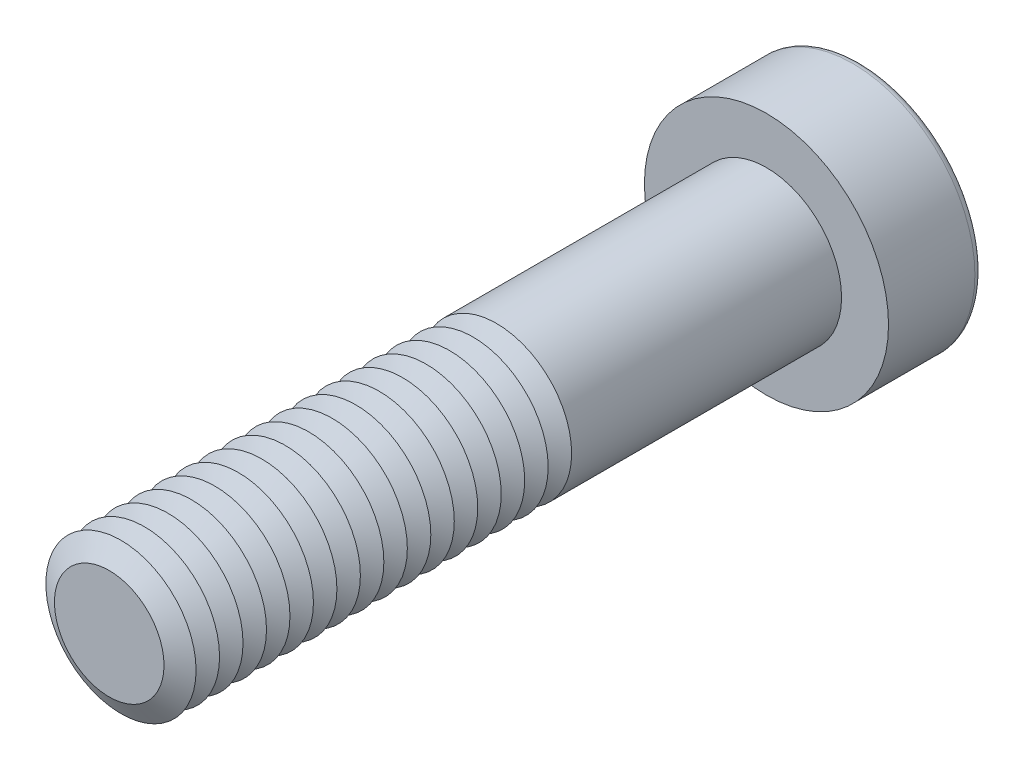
SolidWorks part; units mm, degrees
ref_plane "Front Plane" through (0, 0, 0) normal (0, 0, 1) x (1, 0, 0)
ref_plane "Top Plane" through (0, 0, 0) normal (0, 1, 0) x (1, 0, 0)
ref_plane "Right Plane" through (0, 0, 0) normal (1, 0, 0) x (0, 0, -1)
sketch "Sketch1" plane through (0, 0, 0) normal (0, 0, 1) x (1, 0, 0)
  circle A0 centre (0, 0) radius 4
  dimension "D1" = 8
extrude "Boss-Extrude1" add sketch "Sketch1" along normal blind 35
sketch "Sketch2" plane through (0, 0, 0) normal (0, 0, -1) x (-1, 0, 0)
  circle A0 centre (0, 0) radius 6.5
  dimension "D1" = 13
extrude "Boss-Extrude2" add sketch "Sketch2" along normal blind 5
sketch "Sketch3" plane through (0, 0, -5) normal (0, 0, -1) x (-1, 0, 0)
  line L1 (-1.4434, 2.5) -> (-2.8868, 0)
  line L2 (-2.8868, 0) -> (-1.4434, -2.5)
  line L3 (-1.4434, -2.5) -> (1.4434, -2.5)
  line L4 (1.4434, -2.5) -> (2.8868, 0)
  line L5 (2.8868, 0) -> (1.4434, 2.5)
  line L6 (1.4434, 2.5) -> (-1.4434, 2.5)
  circle A0 centre (0, 0) radius 2.5 construction
  dimension "D1" = 5
extrude "Cut-Extrude1" cut sketch "Sketch3" against normal blind 3.75
fillet "Fillet1" radius 0.4 1 edges at (-6.5, 0, -5)
sketch "Sketch4" plane through (0, 0, -1.25) normal (0, 0, -1) x (-1, 0, 0)
  line L0 (1.4434, -2.5) -> (2.8868, 0) construction
  circle A0 centre (0, 0) radius 2.5
extrude "Cut-Extrude2" cut sketch "Sketch4" against normal through all draft 60
sketch "Sketch5" plane through (0, 0, -5) normal (0, 0, -1) x (-1, 0, 0)
  circle A0 centre (0, 0) radius 2.8868
extrude "Cut-Extrude3" cut sketch "Sketch5" against normal through all draft 75
sketch "Sketch7" plane through (0, 0, 0) normal (1, 0, 0) x (0, 0, -1)
  line L25 (-35, 2.9175) -> (-34.375, 4)
  line L26 (-35, 4) -> (-35, -4) construction
  line L27 (-34.375, 4) -> (-35.625, 4)
  line L28 (-35.625, 4) -> (-35, 2.9175)
  line L29 (0, 4) -> (-35, 4) construction
  dimension "D1" = 1.25
revolve "Cut-Revolve1" cut sketch "Sketch7" angle 360 about axis through (0, 0, 35) along (0, 0, -1)
pattern_linear "LPattern1" count 17 spacing 1.25 along (0, 0, -1) of "Cut-Revolve1"
